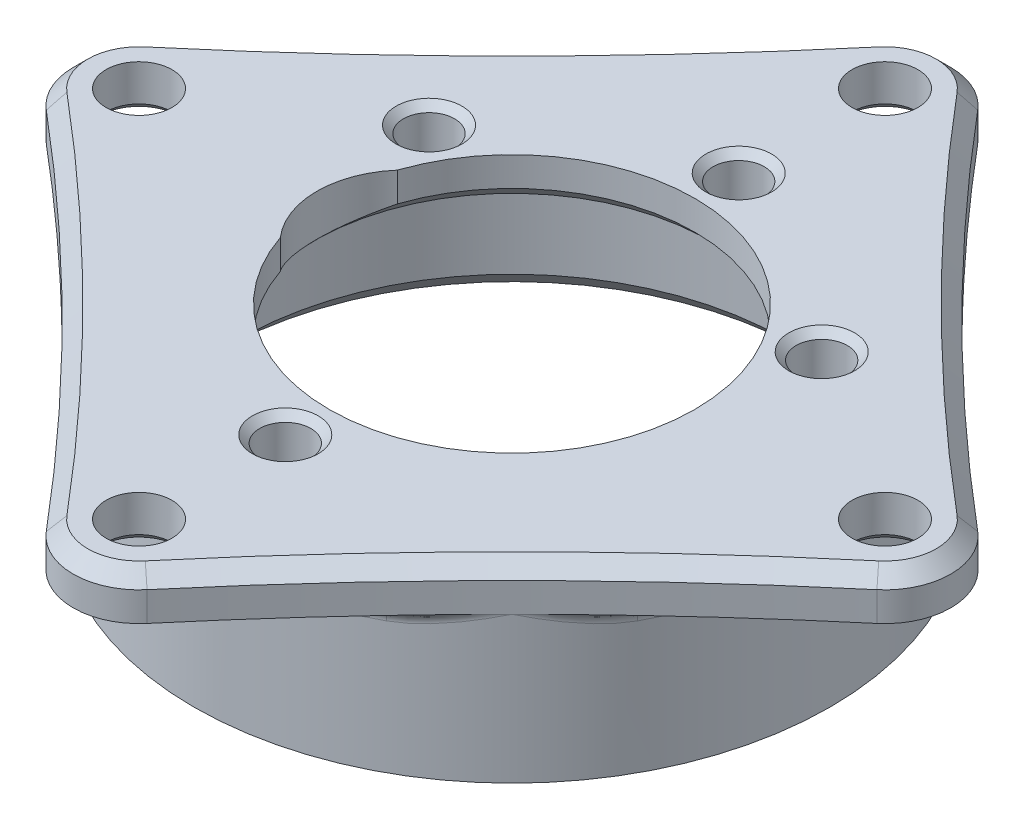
SolidWorks part; units mm, degrees
ref_plane "Front Plane" through (0, 0, 0) normal (0, 0, 1) x (1, 0, 0)
ref_plane "Top Plane" through (0, 0, 0) normal (0, 1, 0) x (1, 0, 0)
ref_plane "Right Plane" through (0, 0, 0) normal (1, 0, 0) x (0, 0, -1)
sketch "Sketch1" plane through (0, 0, 0) normal (0, 1, 0) x (1, 0, 0)
  circle A0 centre (0, 0) radius 18.75
  circle A1 centre (0, 0) radius 21.75
  dimension "D1" = 3
  dimension "D2" = 37.5
extrude "Boss-Extrude1" add sketch "Sketch1" against normal blind 10
sketch "Sketch2" plane through (0, 0, 0) normal (0, 1, 0) x (1, 0, 0)
  line L1 (30, -30) -> (-30, -30)
  line L2 (30, -30) -> (30, 30)
  line L3 (30, 30) -> (-30, 30)
  line L4 (-30, -30) -> (-30, 30)
  line L5 (30, -30) -> (-30, 30) construction
  line L6 (30, 30) -> (-30, -30) construction
  circle A0 centre (0, 0) radius 12.5
  circle A1 centre (0, 0) radius 21.75 construction
  circle A2 centre (0, 0) radius 21.75 construction
  dimension "D1" = 25
  dimension "D2" = 60
  dimension "D3" = 60
extrude "Boss-Extrude2" add sketch "Sketch2" along normal blind 3
sketch "Sketch3" plane through (0, 3, 0) normal (0, 1, 0) x (1, 0, 0)
  line L0 (0, 0) -> (0, -15.5) construction
  line L1 (0, 0) -> (0, 15.5) construction
  line L2 (0, 0) -> (25.5, 0) construction
  line L3 (30, -30) -> (30, 30) construction
  line L4 (30, 30) -> (-30, 30) construction
  line L5 (30, 30) -> (0, 30)
  line L6 (30, 0) -> (30, 30)
  line L7 (0, -30) -> (30, -30)
  line L8 (30, -30) -> (30, 0)
  line L9 (-30, 0) -> (-30, -30)
  line L10 (-30, -30) -> (0, -30)
  line L11 (0, 30) -> (-30, 30)
  line L12 (-30, 30) -> (-30, 0)
  circle A0 centre (0, 0) radius 15.5 construction
  circle A1 centre (0, -15.5) radius 1.75
  circle A2 centre (0, 15.5) radius 1.75
  circle A3 centre (-13.4234, 7.75) radius 1.75
  circle A4 centre (13.4234, 7.75) radius 1.75
  circle A5 centre (25.5, 0) radius 2.25
  circle A6 centre (0, -25.5) radius 2.25
  circle A7 centre (-25.5, 0) radius 2.25
  circle A8 centre (0, 25.5) radius 2.25
  arc A9 (3.4453, 28.3948) -> (0, 30) centre (0, 25.5) ccw
  arc A10 (30, 0) -> (28.3948, 3.4453) centre (25.5, 0) ccw
  circle A12 centre (0, 0) radius 21.75 construction
  circle A13 centre (0, 0) radius 21.75 construction
  arc A14 (3.4453, 28.3948) -> (28.3948, 3.4453) centre (159.6137, 159.6137) ccw
  arc A15 (28.3948, -3.4453) -> (30, 0) centre (25.5, 0) ccw
  arc A16 (28.3948, -3.4453) -> (3.4453, -28.3948) centre (159.6137, -159.6137) ccw
  arc A17 (0, -30) -> (3.4453, -28.3948) centre (0, -25.5) ccw
  arc A18 (-3.4453, -28.3948) -> (0, -30) centre (0, -25.5) ccw
  arc A19 (-3.4453, -28.3948) -> (-28.3948, -3.4453) centre (-159.6137, -159.6137) ccw
  arc A20 (-30, 0) -> (-28.3948, -3.4453) centre (-25.5, 0) ccw
  arc A21 (-28.3948, 3.4453) -> (-30, 0) centre (-25.5, 0) ccw
  arc A22 (-28.3948, 3.4453) -> (-3.4453, 28.3948) centre (-159.6137, 159.6137) ccw
  arc A23 (0, 30) -> (-3.4453, 28.3948) centre (0, 25.5) ccw
  point P14 (0, 0)
  point P25 (0, 0)
  point P60 (0, 0)
extrude "Cut-Extrude2" cut sketch "Sketch3" against normal blind 3 contours A23 L6 A10 A21 A22 | A9 A14 A10 L6 | A8 | A3 | A2 | A7 | A4 | A5 | A1 | A20 A10 A13 A18 A19 | A17 A13 A14 A15 A16 | A6
chamfer "Chamfer1" distance 0.5 angle 45 8 edges at (0, 0, 27.75) (13.4234, 3, -6) (0, 3, -13.75) (-13.4234, 3, -6) (0, 3, 17.25) (25.5, 0, 2.25) (0, 0, -23.25) (-25.5, 0, 2.25)
chamfer "Chamfer2" distance 1 angle 45 8 edges at (0, 3, -30) (15.3796, 3, -15.3796) (30, 3, 0) (15.3796, 3, 15.3796) (0, 3, 30) (-15.3796, 3, 15.3796) (-30, 3, 0) (-15.3796, 3, -15.3796)
fillet "Fillet1" radius 1 4 edges at (21.75, 0, 0) (0, 0, 21.75) (-21.75, 0, 0) (0, 0, -21.75)
chamfer "Chamfer3" distance 1 angle 45 1 edges at (0, 0, 18.75)
chamfer "Chamfer4" distance 1.5 angle 45 1 edges at (0, -10, 18.75)
chamfer "Chamfer5" distance 1 angle 45 1 edges at (0, 0, 12.5)
sketch "Sketch4" plane through (0, 3, 0) normal (0, 1, 0) x (1, 0, 0)
  line L0 (0, 0) -> (-11.8427, 0) construction
  line L1 (-11.8427, 4) -> (-11.8427, -4) construction
  line L2 (-11.8427, 0) -> (-13.3427, 0) construction
  arc A0 (-11.8427, -4) -> (-11.8427, 4) centre (-7.2594, 0) cw
  circle A1 centre (0, 0) radius 12.5 construction
  arc A2 (-11.8427, 4) -> (-11.8427, -4) centre (0, 0) ccw
  point P5 (-11.8427, 0)
  point P11 (0, 0)
  point P12 (0, 0)
  dimension "D2" = 8
  dimension "D3" = 1.5
extrude "Cut-Extrude3" cut sketch "Sketch4" against normal up to next
equation "\"D4@Sketch3\"=\"D5@Sketch3\"*1"
